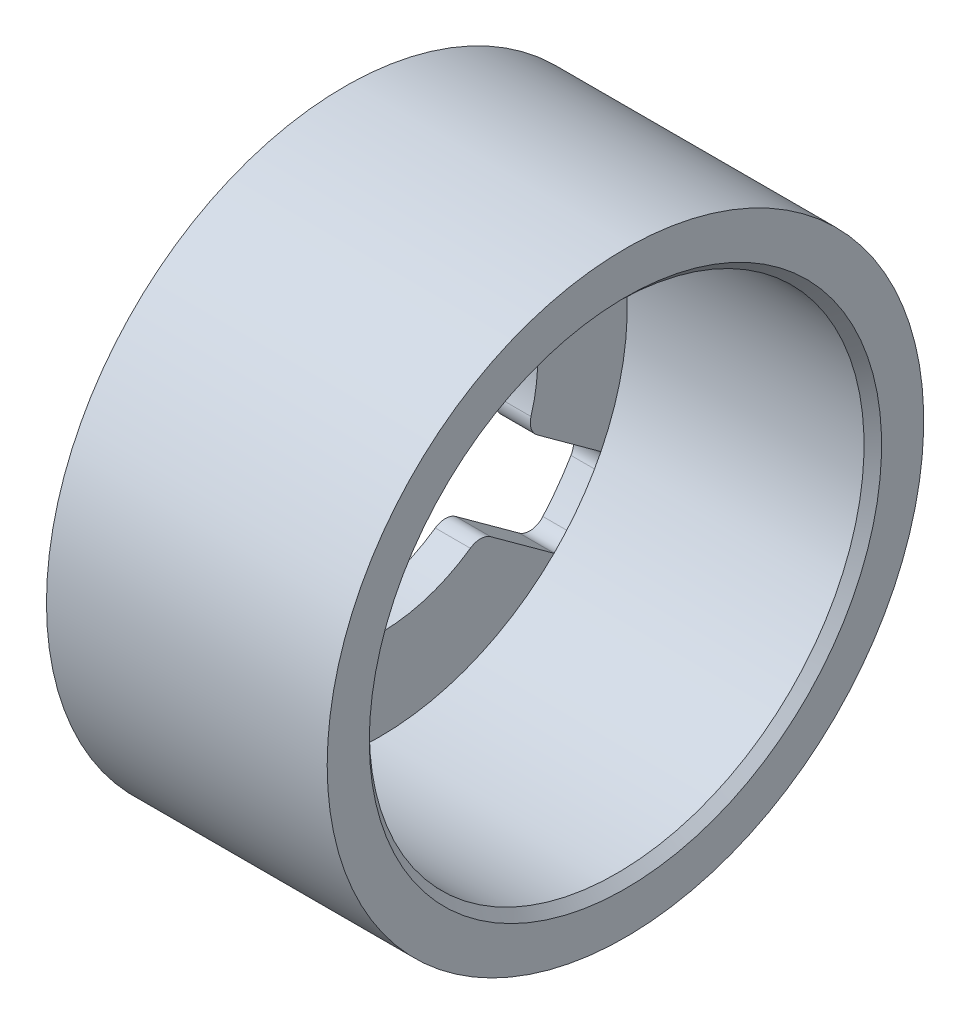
SolidWorks part; units mm, degrees
ref_plane "前视基准面" through (0, 0, 0) normal (0, 0, 1) x (1, 0, 0)
ref_plane "上视基准面" through (0, 0, 0) normal (0, 1, 0) x (1, 0, 0)
ref_plane "右视基准面" through (0, 0, 0) normal (1, 0, 0) x (0, 0, -1)
sketch "草图2" plane through (0, 0, 0) normal (0, 1, 0) x (1, 0, 0)
  line L0 (-68.5531, 0) -> (68.5531, 0) construction
  line L1 (0, 57.8778) -> (0, -48.6174) construction
  line L2 (8, 15.9) -> (-8, 15.9)
  line L3 (-8, 15.9) -> (-8, 14.1)
  line L7 (-8, 14.1) -> (8, 14.1)
  line L9 (8, 14.1) -> (8, 15.9)
  point P7 (0, 14.1)
  point P13 (0, 15.9)
  dimension "D1" = 14.1
  dimension "D2" = 16
  dimension "D3" = 1.8
revolve "旋转1" add sketch "草图2" angle 360 about L0
sketch "草图4" plane through (-8, 0, 0) normal (1, 0, 0) x (0, 0, -1)
  line L2 (-20.2624, 0) -> (19.0232, 0) construction
  line L4 (-0.5437, 8.9836) -> (-2.7151, 15.6665)
  line L5 (8.3879, -3.2623) -> (14.0758, -7.3948)
  line L7 (8.3759, 3.2932) -> (13.7771, 7.2174)
  line L8 (-0.5107, -8.9855) -> (-2.6832, -15.672)
  line L9 (5.7203, -6.9483) -> (11.4051, -11.0785)
  line L10 (-8.7035, -2.291) -> (-15.3834, -2.291)
  line L11 (-4.8406, -7.5874) -> (-6.9036, -13.937)
  line L12 (-4.8684, 7.5696) -> (-7.041, 14.256)
  line L13 (-8.7119, 2.259) -> (-15.3882, 2.259)
  line L14 (5.6947, 6.9693) -> (11.3825, 11.1017)
  line L15 (0, 0) -> (3.2234, 9.955) construction
  arc A0 (13.7921, -7.1887) -> (13.7771, 7.2174) centre (0, 0) ccw
  arc A1 (-8.7035, -2.291) -> (-4.8406, -7.5874) centre (0, 0) ccw
  circle A2 centre (0, 0) radius 15.9 construction
  arc A3 (8.3879, -3.2623) -> (8.3759, 3.2932) centre (0, 0) ccw
  arc A4 (-2.5749, -15.3385) -> (11.1215, -10.8725) centre (0, 0) ccw
  arc A5 (11.0989, 10.8956) -> (-2.6068, 15.3331) centre (0, 0) ccw
  arc A6 (-4.8684, 7.5696) -> (-8.7119, 2.259) centre (0, 0) ccw
  arc A7 (5.6947, 6.9693) -> (-0.5437, 8.9836) centre (0, 0) ccw
  arc A8 (-0.5107, -8.9855) -> (5.7203, -6.9483) centre (0, 0) ccw
  arc A9 (-6.9326, 13.9226) -> (-15.3882, 2.259) centre (0, 0) ccw
  arc A10 (-15.3834, -2.291) -> (-6.9036, -13.937) centre (0, 0) ccw
  point P39 (0, 0)
  dimension "D1" = 5
  dimension "D3" = 9
  dimension "D2" = 4.55
chamfer "倒角1" distance 0.5 angle 45 1 edges at (8, 0, 14.1)
extrude "凸台-拉伸3" add sketch "草图4" along normal blind 2 contours L12 A6 L13 M68 | L14 A7 L4 M68 | L5 A3 L7 M68 | L8 A8 L9 M68 | L10 A1 L11 M68
fillet "圆角1" radius 1 10 edges at (-7, -8.9855, 0.5107) (-7, -6.9483, -5.7203) (-7, 3.2932, -8.3759) (-7, -3.2623, -8.3879) (-7, 6.9693, -5.6947) (-7, 8.9836, 0.5437) (-7, -7.5874, 4.8406) (-7, -2.291, 8.7035) (-7, 2.259, 8.7119) (-7, 7.5696, 4.8684)
sketch "草图5" plane through (-8, 0, 0) normal (-1, 0, 0) x (0, 0, 1)
  line L0 (0, 0) -> (-25.128, 0) construction
  circle A0 centre (0, 0) radius 10.5 construction
  circle A1 centre (-10.5, 0) radius 1
  dimension "D1" = 21
  dimension "D2" = 2
sketch "草图6" plane through (-8, 0, 0) normal (-1, 0, 0) x (0, 0, 1)
  circle A0 centre (0, 0) radius 15.9
  circle A1 centre (0, 0) radius 17
  dimension "D1" = 34
extrude "凸台-拉伸4" add sketch "草图6" against normal up to surface (16 mm away)
sketch "草图7" plane through (-8, 0, 0) normal (-1, 0, 0) x (0, 0, 1)
  line L0 (0, 0) -> (15, 0) construction
  line L1 (13.9179, 2.259) -> (14.8289, 2.259)
  line L2 (13.9126, -2.291) -> (14.824, -2.291)
  line L3 (6.4493, -12.5386) -> (6.7308, -13.4051)
  line L4 (2.1204, -13.9397) -> (2.402, -14.8064)
  line L5 (0, 0) -> (4.6353, -14.2658) construction
  line L6 (-9.932, -10.0083) -> (-10.669, -10.5438)
  line L7 (-12.6022, -6.3242) -> (-13.3395, -6.8599)
  line L8 (0, 0) -> (-12.1353, -8.8168) construction
  line L9 (-12.5876, 6.3532) -> (-13.3247, 6.8887)
  line L10 (-9.9089, 10.0311) -> (-10.6463, 10.5668)
  line L11 (0, 0) -> (-12.1353, 8.8168) construction
  line L12 (2.1524, 13.9347) -> (2.434, 14.8012)
  line L13 (6.4781, 12.5237) -> (6.7597, 13.3905)
  line L14 (0, 0) -> (4.6353, 14.2658) construction
  arc A0 (14.824, -2.291) -> (14.8289, 2.259) centre (0, 0) ccw
  arc A1 (13.9126, -2.291) -> (13.9179, 2.259) centre (0, 0) ccw construction
  arc A2 (13.9126, -2.291) -> (13.9179, 2.259) centre (0, 0) ccw
  arc A3 (2.402, -14.8064) -> (6.7308, -13.4051) centre (0, 0) ccw
  arc A4 (2.1204, -13.9397) -> (6.4493, -12.5386) centre (0, 0) ccw
  arc A5 (-13.3395, -6.8599) -> (-10.669, -10.5438) centre (0, 0) ccw
  arc A6 (-12.6022, -6.3242) -> (-9.932, -10.0083) centre (0, 0) ccw
  arc A7 (-10.6463, 10.5668) -> (-13.3247, 6.8887) centre (0, 0) ccw
  arc A8 (-9.9089, 10.0311) -> (-12.5876, 6.3532) centre (0, 0) ccw
  arc A9 (6.7597, 13.3905) -> (2.434, 14.8012) centre (0, 0) ccw
  arc A10 (6.4781, 12.5237) -> (2.1524, 13.9347) centre (0, 0) ccw
  point P31 (0, 0)
  dimension "D1" = 30
  dimension "D2" = 5
extrude "切除-拉伸1" cut sketch "草图7" against normal blind 2
fillet "圆角2" radius 1 10 edges at (-7, -2.291, 14.824) (-7, 2.259, 14.8289) (-7, -13.4051, 6.7308) (-7, -14.8064, 2.402) (-7, -10.5438, -10.669) (-7, -6.8599, -13.3395) (-7, 6.8887, -13.3247) (-7, 10.5668, -10.6463) (-7, 13.3905, 6.7597) (-7, 14.8012, 2.434)
